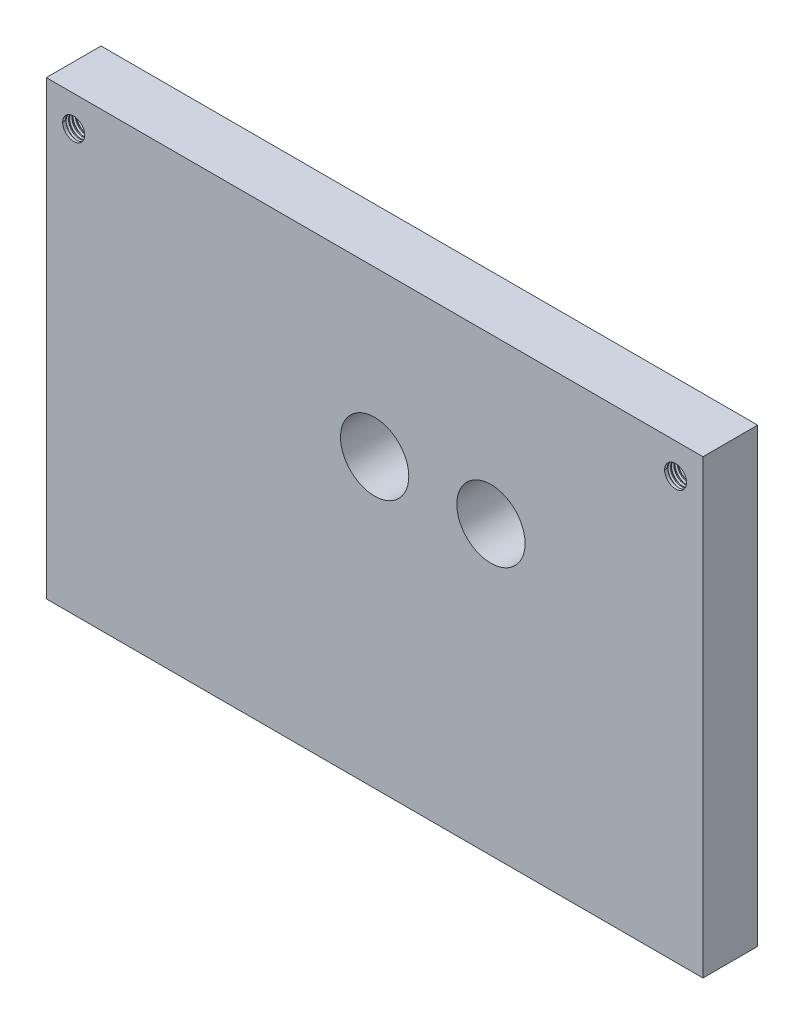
SolidWorks part; units mm, degrees
ref_plane "Front Plane" through (0, 0, 0) normal (0, 0, 1) x (1, 0, 0)
ref_plane "Top Plane" through (0, 0, 0) normal (0, 1, 0) x (1, 0, 0)
ref_plane "Right Plane" through (0, 0, 0) normal (1, 0, 0) x (0, 0, -1)
sketch "Sketch1" plane through (0, 0, 0) normal (0, 0, 1) x (1, 0, 0)
  line L0 (0, -14.2875) -> (0, 30.26) construction
  line L1 (-76.2, -66.675) -> (76.2, -66.675)
  line L2 (-76.2, -66.675) -> (-76.2, 38.1)
  line L3 (-76.2, 38.1) -> (76.2, 38.1)
  line L4 (76.2, -66.675) -> (76.2, 38.1)
  line L5 (-76.2, -66.675) -> (76.2, 38.1) construction
  line L6 (-76.2, 38.1) -> (76.2, -66.675) construction
  point P0 (0, -14.2875)
  dimension "D4" = 66.675
  dimension "D1" = 152.4
  dimension "D2" = 104.775
  dimension "D3" = 0
extrude "Boss-Extrude2" add sketch "Sketch1" along normal blind 12.7 contours L2 L3 L4 L1
sketch "Sketch2" plane through (0, 0, 12.7) normal (0, 0, 1) x (1, 0, 0)
  circle A0 centre (0, 0) radius 7.9223
  circle A1 centre (26.9875, 0) radius 7.9223
  dimension "D1" = 26.9875
  dimension "D2" = 15.8445
  dimension "D3" = 15.8445
extrude "Cut-Extrude2" cut sketch "Sketch2" against normal blind 12.7
sketch "Sketch35" plane through (0, -66.675, 0) normal (0, -1, 0) x (-1, 0, 0)
  line L0 (76.2, 0) -> (-76.2, 0) construction
  point P0 (0, -6.3907)
  point P1 (63.5, -6.3907)
  point P2 (-63.5, -6.3907)
  point P3 (0, 0)
  dimension "D1" = 63.5
  dimension "D2" = 6.3907
  dimension "D3" = 6.3907
hole_wizard "Tap Drill for #10-32 Tap4" positions "Sketch36" profile "Sketch37" hole size "#10-32" standard "ANSI Inch"
sketch "Sketch36" plane through (0, -66.675, 0) normal (0, -1, 0) x (-1, 0, 0)
  point P0 (63.5, -6.3907)
  point P3 (0, -6.3907)
  point P6 (-63.5, -6.3907)
sketch "Sketch37" plane through (-63.5, -66.675, 6.3907) normal (1, 0, 0) x (0, 0, -1)
  line L0 (0, 0) -> (0, 13.9133)
  line L1 (0, 13.9133) -> (2.0193, 12.7)
  line L2 (2.0193, 12.7) -> (2.0193, 0)
  line L5 (2.0193, 0) -> (0, 0)
  line L10 (0, 13.9133) -> (-2.0193, 12.7) construction
  line L11 (0, -6.35) -> (0, 107.95) construction
  dimension "Hole Dia." = 4.0386
  dimension "Hole Depth" = 12.7
  dimension "Drill Angle" = 118
thread "Thread11" pitch 0.7937 start angle 0, offset 0, length 12.7, pitch 0.7937, diameter 4.0386
ref_plane "Plane13" through (2.0193, -66.675, 6.3907) normal (0, 0, 1) x (0.9986, 0.0523, 0)
sketch "Thread Profile13" plane through (2.0193, -66.675, 6.3907) normal (0, 0, 1) x (0.9986, 0.0523, 0)
  line L0 (0, 0) -> (0, 0.7937) construction
  line L1 (0, 0) -> (0.4296, 0.248)
  line L2 (0.4296, 0.248) -> (0.4296, 0.3473)
  line L3 (0.4296, 0.3473) -> (0, 0.5953)
  line L4 (0.4296, 0.2977) -> (0, 0.2977) construction
  line L11 (0, 0) -> (0, 0.5953)
  point P2 (0, 0)
  dimension "Pitch" = 0.7937
  dimension "Profile_Angle" = 60
  dimension "Profile_Land" = 0.0992
  dimension "Profile_Height" = 0.4296
thread "Thread12" pitch 0.7937 start angle 0, offset 0, length 12.7, pitch 0.7937, diameter 4.0386
ref_plane "Plane14" through (61.4807, -53.975, 6.3907) normal (0, 0, 1) x (-0.9986, -0.0523, 0)
sketch "Thread Profile14" plane through (61.4807, -53.975, 6.3907) normal (0, 0, 1) x (-0.9986, -0.0523, 0)
  line L0 (0, 0) -> (0, 0.7937) construction
  line L1 (0, 0) -> (0.4296, 0.248)
  line L2 (0.4296, 0.248) -> (0.4296, 0.3473)
  line L3 (0.4296, 0.3473) -> (0, 0.5953)
  line L4 (0.4296, 0.2977) -> (0, 0.2977) construction
  line L11 (0, 0) -> (0, 0.5953)
  point P2 (0, 0)
  dimension "Pitch" = 0.7937
  dimension "Profile_Angle" = 60
  dimension "Profile_Land" = 0.0992
  dimension "Profile_Height" = 0.4296
sketch "Sketch48" plane through (0, 0, 12.7) normal (0, 0, 1) x (1, 0, 0)
  line L0 (-76.2, -66.675) -> (-76.2, 38.1) construction
  line L1 (0, -6.985) -> (0, 6.985) construction
  point P0 (-69.85, 30.9959)
  point P7 (69.85, 30.9959)
  dimension "D1" = 6.35
hole_wizard "Tap Drill for 1/4-20 Tap1" positions "Sketch49" profile "Sketch50" hole size "1/4-20" standard "ANSI Inch"
sketch "Sketch49" plane through (0, 0, 12.7) normal (0, 0, 1) x (1, 0, 0)
  point P0 (-69.85, 30.9959)
  point P3 (69.85, 30.9959)
sketch "Sketch50" plane through (-69.85, 30.9959, 12.7) normal (1, 0, 0) x (0, -1, 0)
  line L0 (0, 0) -> (0, 12.7)
  line L1 (0, 12.7) -> (2.5527, 12.7)
  line L2 (2.5527, 12.7) -> (2.5527, 0)
  line L5 (2.5527, 0) -> (0, 0)
  line L11 (0, -6.35) -> (0, 107.95) construction
  dimension "Thru Hole Dia." = 5.1054
  dimension "Thru Hole Depth" = 12.7
thread "Thread13" pitch 0.7937 start angle 0, offset 0, length 12.7, pitch 0.7937, diameter 5.1054
ref_plane "Plane15" through (-72.4027, 30.9959, 12.7) normal (0, -1, 0) x (-0.9986, 0, -0.0523)
sketch "Thread Profile15" plane through (-72.4027, 30.9959, 12.7) normal (0, -1, 0) x (-0.9986, 0, -0.0523)
  line L0 (0, 0) -> (0, 0.7937) construction
  line L1 (0, 0) -> (0.4296, 0.248)
  line L2 (0.4296, 0.248) -> (0.4296, 0.3473)
  line L3 (0.4296, 0.3473) -> (0, 0.5953)
  line L4 (0.4296, 0.2977) -> (0, 0.2977) construction
  line L11 (0, 0) -> (0, 0.5953)
  point P2 (0, 0)
  dimension "Pitch" = 0.7937
  dimension "Profile_Angle" = 60
  dimension "Profile_Land" = 0.0992
  dimension "Profile_Height" = 0.4296
thread "Thread14" pitch 0.7937 start angle 0, offset 0, length 12.7, pitch 0.7937, diameter 5.1054
ref_plane "Plane16" through (67.2973, 30.9959, 12.7) normal (0, -1, 0) x (-0.9986, 0, -0.0523)
sketch "Thread Profile16" plane through (67.2973, 30.9959, 12.7) normal (0, -1, 0) x (-0.9986, 0, -0.0523)
  line L0 (0, 0) -> (0, 0.7937) construction
  line L1 (0, 0) -> (0.4296, 0.248)
  line L2 (0.4296, 0.248) -> (0.4296, 0.3473)
  line L3 (0.4296, 0.3473) -> (0, 0.5953)
  line L4 (0.4296, 0.2977) -> (0, 0.2977) construction
  line L11 (0, 0) -> (0, 0.5953)
  point P2 (0, 0)
  dimension "Pitch" = 0.7937
  dimension "Profile_Angle" = 60
  dimension "Profile_Land" = 0.0992
  dimension "Profile_Height" = 0.4296
sketch "Sketch51" plane through (0, -66.675, 0) normal (0, -1, 0) x (1, 0, 0)
  circle A0 centre (-63.5, 6.3907) radius 2.413
  circle A1 centre (0, 6.3907) radius 2.413
  circle A2 centre (63.5, 6.3907) radius 2.413
extrude "Cut-Extrude3" cut sketch "Sketch51" against normal blind 19.05
thread "Thread10" pitch 0.7937 start angle 0, offset 0, length 19.05, pitch 0.7937, diameter 4.826
ref_plane "Plane12" through (-61.087, -66.675, 6.3907) normal (0, 0, 1) x (0.9986, 0.0523, 0)
sketch "Thread Profile12" plane through (-61.087, -66.675, 6.3907) normal (0, 0, 1) x (0.9986, 0.0523, 0)
  line L0 (0, 0) -> (0, 0.7937) construction
  line L1 (0, 0) -> (0.4296, 0.248)
  line L2 (0.4296, 0.248) -> (0.4296, 0.3473)
  line L3 (0.4296, 0.3473) -> (0, 0.5953)
  line L4 (0.4296, 0.2977) -> (0, 0.2977) construction
  line L11 (0, 0) -> (0, 0.5953)
  point P2 (0, 0)
  dimension "Pitch" = 0.7937
  dimension "Profile_Angle" = 60
  dimension "Profile_Land" = 0.0992
  dimension "Profile_Height" = 0.4296
pattern_linear "LPattern1" count 3 spacing 63.5 of "Thread10"
ref_plane "Plane17" through (0, 0, 6.35) normal (0, 0, 1) x (1, 0, 0)
sketch "Sketch52" plane through (0, 0, 6.35) normal (0, 0, 1) x (1, 0, 0)
  line L0 (-63.5, -66.675) -> (-63.5, -46.4209)
  line L1 (0, -66.675) -> (0, -46.4209)
  line L2 (63.5122, -66.675) -> (63.5122, -46.4209)
  line L3 (-76.2, -66.675) -> (76.2, -66.675) construction
ref_plane "Plane18" through (0, 0, 0) normal (0, 0, 1) x (1, 0, 0)
sketch "Sketch53" plane through (0, 0, 0) normal (0, 0, 1) x (1, 0, 0)
  circle A0 centre (0, 0) radius 7.9223
